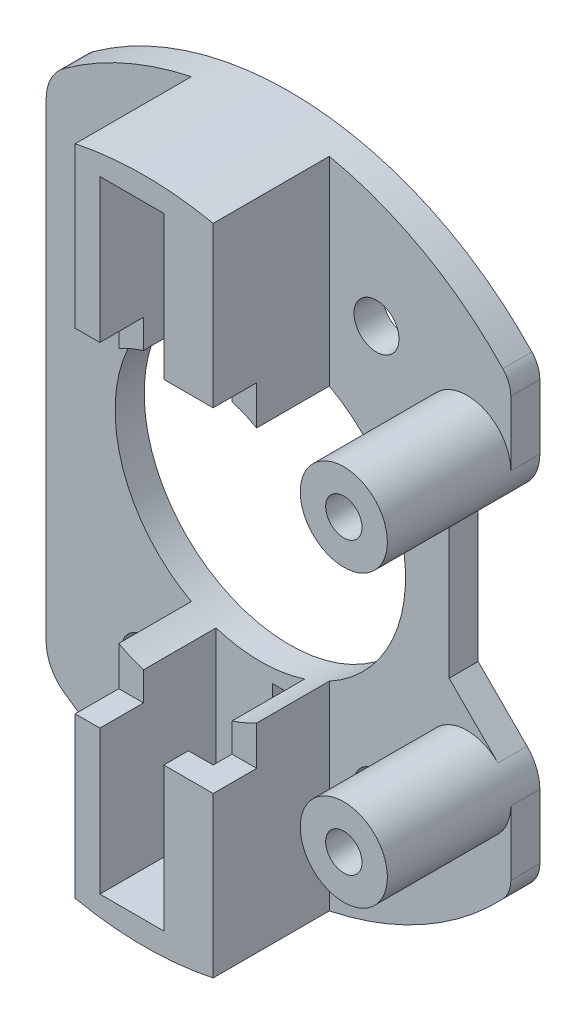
SolidWorks part; units mm, degrees
ref_plane "Plan1" through (0, 0, 0) normal (0, 0, 1) x (1, 0, 0)
ref_plane "Plan2" through (0, 0, 0) normal (0, 1, 0) x (1, 0, 0)
ref_plane "Plan3" through (0, 0, 0) normal (1, 0, 0) x (0, 0, -1)
sketch "Esquisse2" plane through (0, 0, 0) normal (0, 0, 1) x (1, 0, 0)
  line L0 (0, 52.649) -> (0, -4.9664) construction
  line L1 (0, 24.7771) -> (-34.3736, 24.7771) construction
  line L2 (-14.75, 40.9616) -> (-14.75, 8.5926)
  line L3 (13, 29.2771) -> (13, 20.2771)
  line L4 (17.25, 39.2145) -> (17.25, 34.7698)
  line L5 (0, -59.6885) -> (0, -49.3387) construction
  line L6 (3.05, 46.1771) -> (0.85, 46.1771)
  line L7 (13, 29.2771) -> (16.3713, 32.6484)
  line L8 (13, 20.2771) -> (16.3713, 16.9058)
  line L9 (17.25, 14.7845) -> (17.25, 10.3397)
  line L10 (3.05, 46.1771) -> (3.05, 35.6771)
  line L11 (3.05, 35.6771) -> (0.85, 35.6771)
  line L12 (0.85, 46.1771) -> (0.85, 35.6771)
  line L13 (3.05, 13.8771) -> (0.85, 13.8771)
  line L14 (3.05, 3.3771) -> (3.05, 13.8771)
  line L15 (0.85, 3.3771) -> (0.85, 13.8771)
  line L16 (3.05, 3.3771) -> (0.85, 3.3771)
  circle A0 centre (-8, 38.7771) radius 1.55
  circle A1 centre (8, 38.7771) radius 1.55
  circle A2 centre (8, 10.7771) radius 1.55
  circle A3 centre (-8, 10.7771) radius 1.55
  arc A4 (-13.5125, 6.165) -> (16.7024, 8.9648) centre (0, 24.7771) ccw
  circle A5 centre (0, 24.7771) radius 10
  arc A6 (-14.75, 40.9616) -> (-13.5125, 43.3893) centre (-11.75, 40.9616) cw
  arc A7 (-13.5125, 6.165) -> (-14.75, 8.5926) centre (-11.75, 8.5926) cw
  arc A8 (16.7024, 40.5895) -> (-13.5125, 43.3893) centre (0, 24.7771) ccw
  arc A9 (16.7024, 40.5895) -> (17.25, 39.2145) centre (15.25, 39.2145) cw
  arc A10 (17.25, 10.3397) -> (16.7024, 8.9648) centre (15.25, 10.3397) cw
  arc A11 (17.25, 34.7698) -> (16.3713, 32.6484) centre (14.25, 34.7698) cw
  arc A12 (16.3713, 16.9058) -> (17.25, 14.7845) centre (14.25, 14.7845) cw
  circle A13 centre (0, 24.7771) radius 4.25 construction
  point P40 (17.25, 33.5271)
  point P43 (17.25, 16.0271)
  dimension "D1" = 3.1
  dimension "D2" = 46
  dimension "D3" = 20
  dimension "D4" = 14.75
  dimension "D6" = 3
  dimension "D8" = 2
  dimension "D11" = 3
  dimension "D5" = 13
  dimension "D7" = 32
  dimension "D9" = 9
  dimension "D10" = 135
  dimension "D12" = 10.9
  dimension "D13" = 17.8
  dimension "D14" = 10.5
  dimension "D15" = 2.2
extrude "Base-Extrusion" add sketch "Esquisse2" along normal blind 2
sketch "Esquisse3" plane through (0, 0, 2) normal (0, 0, 1) x (1, 0, 0)
  circle A0 centre (14.25, 34.7698) radius 3
  circle A1 centre (14.25, 14.7845) radius 3
  dimension "D1" = 6
extrude "Boss.-Extru.1" add sketch "Esquisse3" along normal blind 8.5
sketch "Esquisse8" plane through (0, 0, 2) normal (0, 0, 1) x (1, 0, 0)
  line L0 (27.8028, 24.7771) -> (0, 24.7771) construction
  line L1 (0, 51.8387) -> (0, 24.7771) construction
  line L2 (3.05, 46.1771) -> (-3.05, 46.1771)
  line L4 (3.05, 46.1771) -> (3.05, 34.3006)
  line L6 (4.75, 47.2813) -> (4.75, 33.577)
  line L8 (-4.75, 47.2813) -> (-4.75, 33.577)
  line L9 (-3.05, 46.1771) -> (-3.05, 34.3006)
  line L10 (4.75, 2.2729) -> (4.75, 15.9773)
  line L11 (3.05, 3.3771) -> (3.05, 15.2536)
  line L12 (-3.05, 3.3771) -> (-3.05, 15.2536)
  line L13 (-4.75, 2.2729) -> (-4.75, 15.9773)
  line L14 (3.05, 3.3771) -> (-3.05, 3.3771)
  circle A4 centre (0, 24.7771) radius 10 construction
  arc A5 (16.7024, 40.5895) -> (-13.5125, 43.3893) centre (0, 24.7771) ccw construction
  arc A6 (4.75, 33.577) -> (3.05, 34.3006) centre (0, 24.7771) ccw
  arc A7 (4.75, 47.2813) -> (-4.75, 47.2813) centre (0, 24.7771) ccw
  arc A8 (-4.75, 33.577) -> (-3.05, 34.3006) centre (0, 24.7771) cw
  arc A9 (4.75, 15.9773) -> (3.05, 15.2536) centre (0, 24.7771) cw
  arc A10 (-4.75, 15.9773) -> (-3.05, 15.2536) centre (0, 24.7771) ccw
  arc A11 (4.75, 2.2729) -> (-4.75, 2.2729) centre (0, 24.7771) cw
  point P17 (0, 46.1771)
  dimension "D1" = 1.7
extrude "Boss.-Extru.4" add sketch "Esquisse8" along normal blind 8
sketch "Esquisse9" plane through (0, 0, 10) normal (0, 0, 1) x (1, 0, 0)
  line L0 (0, 24.7771) -> (24.6979, 24.7771) construction
  line L1 (3.05, 46.1771) -> (3.05, 36.2771)
  line L2 (3.05, 46.1771) -> (3.05, 34.3006) construction
  line L3 (3.05, 36.2771) -> (1.35, 36.2771)
  line L4 (1.35, 36.2771) -> (1.35, 46.1771)
  line L5 (-3.05, 46.1771) -> (3.05, 46.1771) construction
  line L6 (1.35, 46.1771) -> (3.05, 46.1771)
  line L7 (1.35, 13.2771) -> (1.35, 3.3771)
  line L8 (1.35, 3.3771) -> (3.05, 3.3771)
  line L9 (3.05, 3.3771) -> (3.05, 13.2771)
  line L10 (3.05, 13.2771) -> (1.35, 13.2771)
  dimension "D1" = 11.5
  dimension "D2" = 1.7
extrude "Boss.-Extru.6" add sketch "Esquisse9" against normal blind 1.7
sketch "Esquisse10" plane through (0, 0, 10) normal (0, 0, 1) x (1, 0, 0)
  line L0 (8.0455, 36.2771) -> (-10.1308, 36.2771)
  line L1 (1.35, 36.2771) -> (3.05, 36.2771) construction
  line L2 (0, 24.7771) -> (32.0133, 24.7771) construction
  line L3 (8.0455, 13.2771) -> (-10.1308, 13.2771)
  line L4 (8.0455, 36.2771) -> (8.0455, 13.2771)
  line L5 (-10.1308, 36.2771) -> (-10.1308, 13.2771)
extrude "Enlèv. mat.-Extru.1" cut sketch "Esquisse10" against normal blind 3
sketch "Esquisse11" plane through (0, 0, 10.5) normal (0, 0, 1) x (1, 0, 0)
  circle A0 centre (14.25, 34.7698) radius 1.25
  circle A1 centre (14.25, 14.7845) radius 1.25
  dimension "D1" = 2.5
extrude "Enlèv. mat.-Extru.2" cut sketch "Esquisse11" against normal through all
